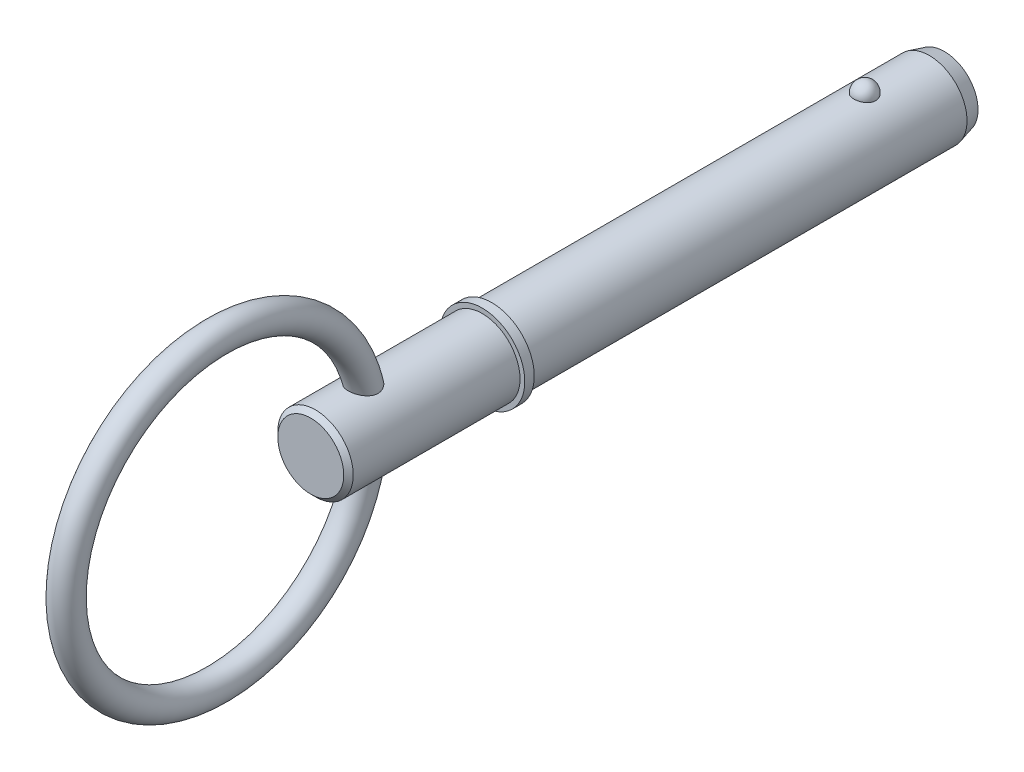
SolidWorks part; units mm, degrees
ref_plane "Front Plane" through (0, 0, 0) normal (0, 0, 1) x (1, 0, 0)
ref_plane "Top Plane" through (0, 0, 0) normal (0, 1, 0) x (1, 0, 0)
ref_plane "Right Plane" through (0, 0, 0) normal (1, 0, 0) x (0, 0, -1)
sketch "Sketch2" plane through (0, 0, 0) normal (0, 0, 1) x (1, 0, 0)
  circle A0 centre (0, 0) radius 3.97
  point P3 (0, 3.97)
  dimension "D1" = 7.94
extrude "Boss-Extrude1" add sketch "Sketch2" along normal blind 38.1
sketch "Sketch3" plane through (0, 0, 0) normal (0, 0, -1) x (-1, 0, 0)
  circle A0 centre (0, 0) radius 3.97
  dimension "D1" = 7.94
extrude "Boss-Extrude2" add sketch "Sketch3" along normal blind 9.53
chamfer "Chamfer1" distance 1.586 angle 15 1 edges at (-3.97, 0, -9.53)
sketch "Sketch18" plane through (0, 0, 0) normal (1, 0, 0) x (0, 0, -1)
  line L0 (7.944, 3.97) -> (-38.1, 3.97) construction
  line L1 (1.15, 5.12) -> (1.15, 2.82)
  line L2 (-38.1, -3.97) -> (7.944, -3.97) construction
  arc A0 (1.15, 5.12) -> (1.15, 2.82) centre (1.15, 3.97) ccw
  point P4 (0, 3.97)
  dimension "D1" = 9.09
revolve "Revolve1" add sketch "Sketch18" angle 360 about L1
sketch "Sketch19" plane through (0, 0, 0) normal (1, 0, 0) x (0, 0, -1)
  line L0 (-33.7288, 0) -> (-46.4542, 0) construction
sketch "Sketch20" plane through (0, 0, 0) normal (1, 0, 0) x (0, 0, -1)
  line L0 (-38.1, 0) -> (-38.1, 4.47)
  line L1 (-38.1, 3.97) -> (-38.1, -3.97) construction
  line L2 (-38.1, 4.47) -> (-39.1, 4.47)
  line L3 (-39.1, 4.47) -> (-39.1, 0)
  line L4 (-33.7288, 0) -> (-46.4542, 0) construction
  line L5 (-39.1, 0) -> (-38.1, 0)
  dimension "D1" = 4.47
  dimension "D2" = 1
revolve "Revolve2" add sketch "Sketch20" angle 360 about L0
sketch "Sketch21" plane through (0, 0, 38.1) normal (0, 0, -1) x (-1, 0, 0)
  circle A0 centre (0, 0) radius 3.97
  dimension "D1" = 7.94
extrude "Boss-Extrude3" add sketch "Sketch21" against normal blind 19.05
chamfer "Chamfer2" distance 0.5 angle 45 1 edges at (-3.97, 0, 57.15)
sketch "Sketch23" plane through (0, 0, 0) normal (1, 0, 0) x (0, 0, -1)
  line L0 (-57.15, 3.47) -> (-57.15, -3.47) construction
  circle A0 centre (-67.025, 0) radius 15.875
  point P2 (-51.15, 0)
  dimension "D1" = 31.75
  dimension "D2" = 6
sketch "Sketch24" plane through (0, 0, 0) normal (0, 1, 0) x (1, 0, 0)
  circle A0 centre (0, -51.15) radius 1.5
  dimension "D1" = 3
sweep "Sweep1" add profiles "Sketch24" path "Sketch23"
